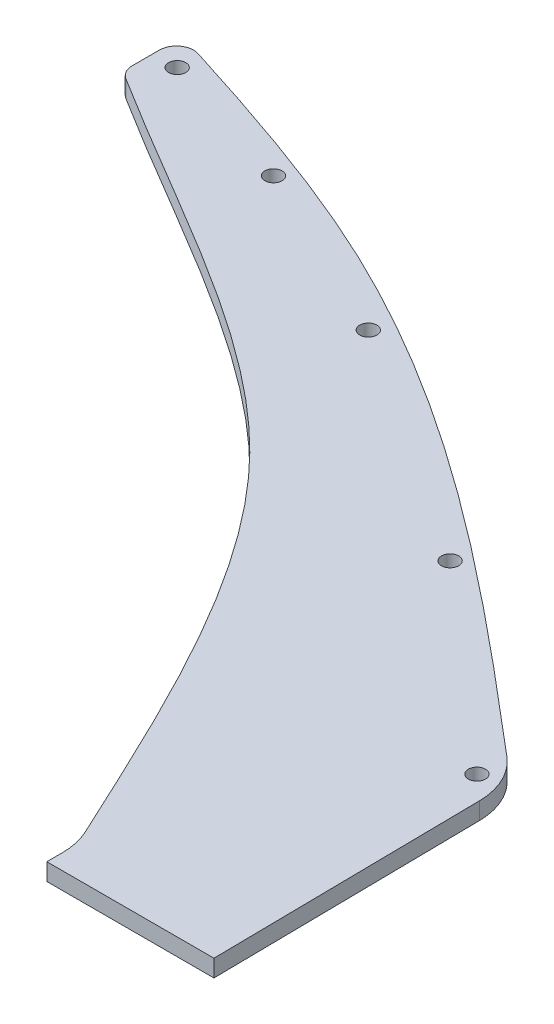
SolidWorks part; units mm, degrees
ref_plane "Front Plane" through (0, 0, 0) normal (0, 0, 1) x (1, 0, 0)
ref_plane "Top Plane" through (0, 0, 0) normal (0, 1, 0) x (1, 0, 0)
ref_plane "Right Plane" through (0, 0, 0) normal (1, 0, 0) x (0, 0, -1)
sketch "Sketch1" plane through (0, 0, 0) normal (0, 1, 0) x (1, 0, 0)
  line L0 (-49.0746, -19.6007) -> (-49.0746, -25.4031)
  line L1 (-288.2827, 245.4458) -> (-288.2827, 255.4242)
  line L2 (-49.0746, -25.4031) -> (-12.6572, -25.4031)
  line L7 (-12.6572, -25.4031) -> (12.7502, -25.4031)
  line L8 (12.7502, -25.4031) -> (11.4383, 74.2316)
  arc A0 (-280.0257, 261.4811) -> (-288.2827, 255.4242) centre (-281.9327, 255.4242) ccw
  arc A1 (-285.3202, 240.0748) -> (-288.2827, 245.4458) centre (-281.9327, 245.4458) cw
  arc A2 (-49.0746, -19.6007) -> (-51.4579, -8.8587) centre (-74.4746, -19.6007) ccw
  arc A3 (11.4383, 74.2316) -> (2.4955, 93.2464) centre (-13.9595, 73.8972) ccw
  spline S0 degree 3 poles (2.4955, 93.2464) (-57.8485, 144.5644) (-143.9559, 216.0622) (-248.9175, 251.6865) (-280.0257, 261.4811) knots 0.030864 0.030864 0.030864 0.030864 0.666307 0.930191 0.930191 0.930191 0.930191
  spline S1 degree 3 poles (-51.4579, -8.8587) (-75.6971, 43.0783) (-106.0595, 110.1008) (-187.4688, 185.1648) (-243.9102, 213.9579) (-285.3202, 240.0748) knots 0.015453 0.015453 0.015453 0.015453 0.486791 0.584156 0.989096 0.989096 0.989096 0.989096
  dimension "D2" = 25.4
  dimension "D1" = 6.35
extrude "Extrude1" add sketch "Sketch1" along normal blind 6.35
sketch "Sketch2" plane through (0, 6.35, 0) normal (0, 1, 0) x (1, 0, 0)
  circle A0 centre (2.4252, 82.2079) radius 3.1813
  circle A1 centre (-279.3791, 253.1267) radius 3.1814
  circle A3 centre (-70.8638, 145.5786) radius 3.1814
  circle A5 centre (-159.9364, 204.3864) radius 3.1814
  circle A7 centre (-226.8919, 236.2558) radius 3.1814
extrude "Extrude2" cut sketch "Sketch2" against normal through all
